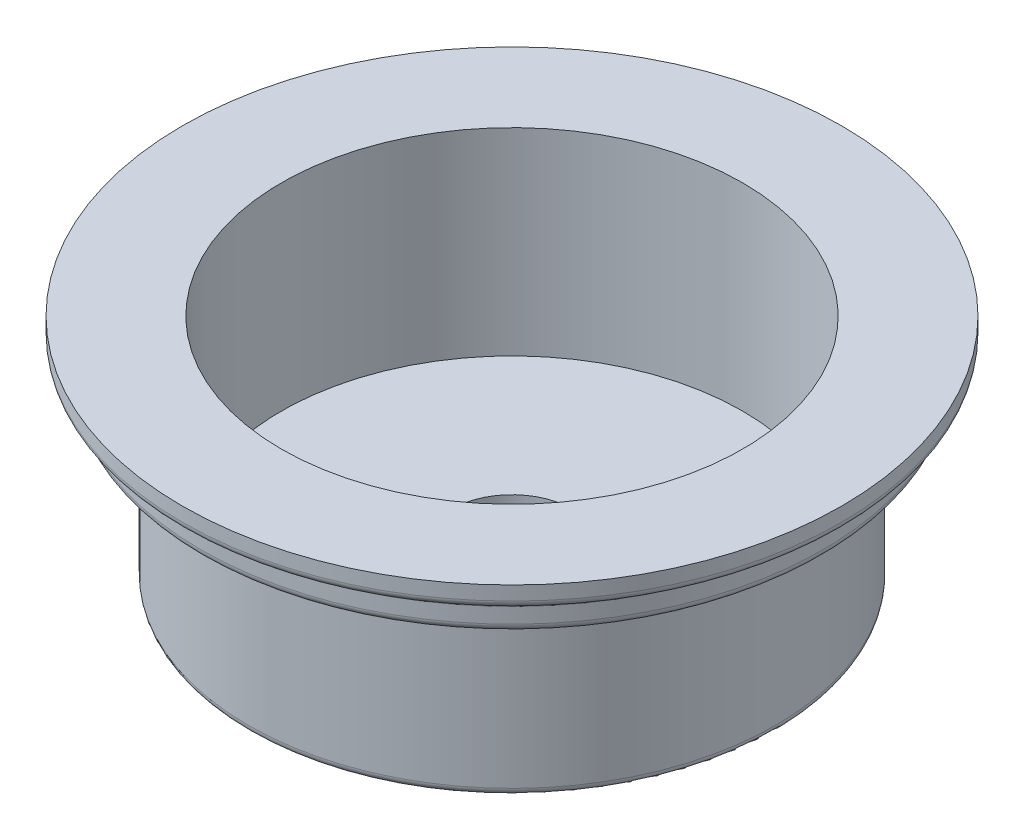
SolidWorks part; units mm, degrees
ref_plane "FRONT" through (0, 0, 0) normal (0, 0, 1) x (1, 0, 0)
ref_plane "TOP" through (0, 0, 0) normal (0, 1, 0) x (1, 0, 0)
ref_plane "RT-SIDE" through (0, 0, 0) normal (1, 0, 0) x (0, 0, -1)
sketch "Sketch1" plane through (0, 0, 0) normal (0, 0, 1) x (1, 0, 0)
  line L0 (0, 0) -> (0, -97.6878) construction
  line L1 (0, -38.1) -> (44.45, -38.1)
  line L2 (44.45, -38.1) -> (44.45, -3.1687)
  line L3 (54.7751, 0) -> (44.45, 0)
  line L4 (50.8, -44.45) -> (44.45, -44.45)
  line L5 (44.45, -44.45) -> (19.05, -57.15)
  line L6 (19.05, -57.15) -> (0, -57.15)
  line L7 (54.7751, 0) -> (63.5, 0)
  line L8 (63.5, 0) -> (63.5, -3.7592)
  line L9 (63.5, -3.7592) -> (59.9186, -5.0627)
  line L10 (59.9186, -5.0627) -> (59.9186, -10.1427)
  line L11 (59.9186, -10.1427) -> (50.8, -13.4616)
  line L12 (50.8, -13.4616) -> (50.8, -44.45)
  line L13 (0, -57.15) -> (0, -38.1)
  line L15 (44.45, 0) -> (44.45, -3.1687)
  dimension "D1" = 6.35
  dimension "D2" = 19.05
  dimension "D3" = 19.05
  dimension "D4" = 44.45
  dimension "D5" = 6.35
  dimension "D7" = 6.35
  dimension "D8" = 63.5
  dimension "D9" = 3.7592
  dimension "D10" = 250
  dimension "D11" = 3.5814
  dimension "D12" = 250
  dimension "D13" = 38.1
  dimension "D15" = 5.08
revolve "Base-Revolve" add sketch "Sketch1" angle 360 about L0
fillet "Fillet1" radius 1.524 7 edges at (0, -3.7592, 63.5) (0, -5.0627, 59.9186) (0, -10.1427, 59.9186) (0, -13.4616, 50.8) (0, -44.45, 50.8) (0, -44.45, 44.45) (0, -57.15, 19.05)
sketch "Sketch4" [suppressed] plane through (0, 0, 0) normal (0, 0, 1) x (1, 0, 0)
  line L0 (-44.45, -3.175) -> (0, -3.1747)
  line L2 (-49.2125, -3.1686) -> (-49.2125, -4.5212)
  line L3 (-49.2125, -4.5212) -> (-54.7751, -4.5212)
  line L4 (-54.7751, -4.5212) -> (-54.7751, 0)
  line L6 (0, -0.0219) -> (0, -46.3872) construction
  line L8 (-54.7751, 0) -> (0, -0.0219)
  line L11 (0, -3.1747) -> (0, -0.0219)
  line L12 (-44.45, 0) -> (-44.45, -76.2) construction
  arc A0 (-44.45, -3.175) -> (-49.2125, -3.1686) centre (-46.8312, -3.1718) ccw
  dimension "D1" = 2.3813
  dimension "D2" = 3.1686
  dimension "D3" = 4.5212
  dimension "D4" = 5.5626
  dimension "D5" = 1.3525
revolve "Cut-Revolve1" [suppressed] cut sketch "Sketch4" angle 360 about L6
hole_wizard "SAE#8" positions "Sketch2" profile "Sketch3" legacy
sketch "Sketch2" plane through (-62.7291, -57.15, 62.1718) normal (0, -1, 0) x (1, 0, 0)
  point P0 (62.7291, -62.1718)
sketch "Sketch3" plane through (0, -57.15, 0) normal (1, 0, 0) x (0, 0, -1)
  line L0 (0, 0) -> (0, 17.4752)
  line L1 (0, 17.4752) -> (8.7312, 17.4752)
  line L2 (8.7312, 17.4752) -> (8.7313, 3.5686)
  line L3 (9.7598, 2.54) -> (10.2997, 0)
  line L4 (10.2997, 0) -> (0, 0)
  line L5 (0, -6.4453) -> (0, 42.3633) construction
  line L6 (-9.6711, 2.9576) -> (-10.2997, 0) construction
  line L7 (8.7313, 3.5686) -> (9.7598, 2.54)
  line L9 (-18.6902, 0) -> (18.6902, 0) construction
  dimension "Diameter" = 17.4625
  dimension "Depth" = 17.4752
  dimension "C-Sink Angle" = 24
  dimension "C-Sink Diameter" = 20.5994
sketch "Sketch5" [suppressed] plane through (2.2552, -39.6748, -1.9034) normal (0, -1, 0) x (1, 0, 0)
  circle A0 centre (-2.2552, 1.9034) radius 4.9657
  dimension "D1" = 9.9314
extrude "Thru hole.172" [suppressed] cut sketch "Sketch5" against normal through all
other "SAE#8-Port<1>" [suppressed]
sketch "Sketch21" plane through (2.6174, -57.15, 3.3625) normal (0, -1, 0) x (1, 0, 0)
  circle A0 centre (-2.6174, -3.3625) radius 13.1445
  dimension "Pipe OD" = 26.289
extrude "NPT" cut sketch "Sketch21" against normal blind 14.0538 draft 1.783
sketch "Sketch31" plane through (2.6174, -57.15, 3.3625) normal (0, -1, 0) x (1, 0, 0)
  circle A0 centre (-2.6174, -3.3625) radius 11.6967
  dimension "D1" = 23.3934
extrude "Tap Drill" cut sketch "Sketch31" against normal blind 38.1
